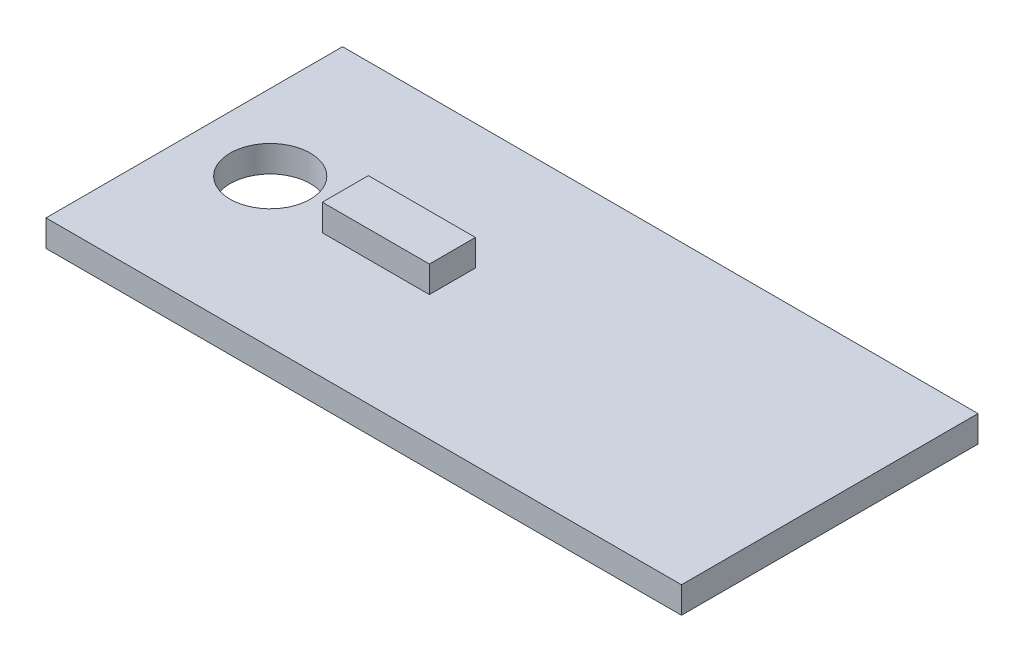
SolidWorks part; units mm, degrees
ref_plane "Front" through (0, 0, 0) normal (0, 0, 1) x (1, 0, 0)
ref_plane "Top" through (0, 0, 0) normal (0, 1, 0) x (1, 0, 0)
ref_plane "Right" through (0, 0, 0) normal (1, 0, 0) x (0, 0, -1)
sketch "Sketch1" plane through (0, 0, 0) normal (0, 1, 0) x (1, 0, 0)
  line L1 (0, 4.445) -> (19.05, 4.445)
  line L2 (0, 4.445) -> (0, -4.445)
  line L3 (0, -4.445) -> (19.05, -4.445)
  line L4 (19.05, 4.445) -> (19.05, -4.445)
  point P4 (0, 0)
  dimension "D1" = 8.89
  dimension "D2" = 19.05
extrude "Boss-Extrude1" add sketch "Sketch1" along normal blind 0.7937
sketch "Sketch2" plane through (0, 0.7937, 0) normal (0, 1, 0) x (1, 0, 0)
  line L1 (4.5284, 0.6899) -> (7.7384, 0.6899)
  line L2 (4.5284, 0.6899) -> (4.5284, -0.6899)
  line L3 (4.5284, -0.6899) -> (7.7384, -0.6899)
  line L4 (7.7384, 0.6899) -> (7.7384, -0.6899)
  point P4 (4.5284, 0)
extrude "Boss-Extrude2" add sketch "Sketch2" along normal blind 0.7937
hole_wizard "M2 Clearance Hole1" positions "Sketch5" profile "Sketch4" hole size "M2" standard "ANSI Metric"
sketch "Sketch5" plane through (0, 0.7937, 0) normal (0, 1, 0) x (1, 0, 0)
  point P0 (2.277, 0)
sketch "Sketch4" plane through (2.277, 0.7937, 0) normal (1, 0, 0) x (0, 0, 1)
  line L0 (0, 0) -> (0, 0.7937)
  line L1 (0, 0.7937) -> (1.2, 0.7937)
  line L2 (1.2, 0.7937) -> (1.2, 0)
  line L5 (1.2, 0) -> (0, 0)
  line L11 (0, -6.35) -> (0, 107.95) construction
  dimension "Thru Hole Dia." = 2.4
  dimension "Thru Hole Depth" = 0.7937
